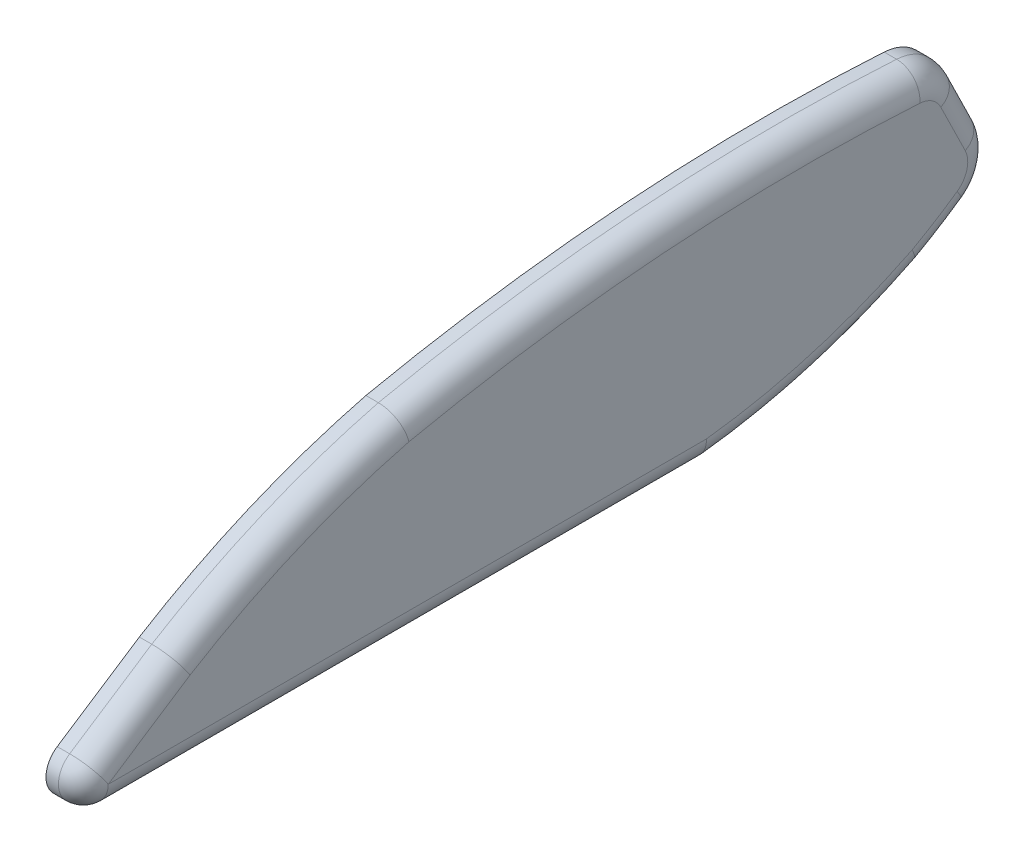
SolidWorks part; units mm, degrees
ref_plane "Alzado" through (0, 0, 0) normal (0, 0, 1) x (1, 0, 0)
ref_plane "Planta" through (0, 0, 0) normal (0, 1, 0) x (1, 0, 0)
ref_plane "Vista lateral" through (0, 0, 0) normal (1, 0, 0) x (0, 0, -1)
sketch "Croquis1" plane through (0, 0, 0) normal (1, 0, 0) x (0, 0, -1)
  line L0 (13448.7874, 5150.8637) -> (13481.7652, 5172.5029)
  line L1 (13454.2736, 5132.5029) -> (13695.0821, 5132.5029)
  line L2 (13797.6803, 5215.2328) -> (13807.4839, 5195.2188)
  arc A0 (13448.7874, 5150.8637) -> (13454.2736, 5132.5029) centre (13454.2736, 5142.5029) ccw
  arc A1 (13572.7711, 5211.0068) -> (13481.7652, 5172.5029) centre (13652.9813, 4894.6253) ccw
  arc A2 (13780.9479, 5226.397) -> (13572.7711, 5211.0068) centre (13733.4027, 4453.8679) ccw
  arc A3 (13797.6803, 5215.2328) -> (13780.9479, 5226.397) centre (13779.7193, 5206.4348) ccw
  arc A4 (13781.7959, 5158.0677) -> (13800.9788, 5170.0267) centre (13677.4696, 5346.7774) ccw
  arc A5 (13800.9788, 5170.0267) -> (13807.4839, 5195.2188) centre (13789.523, 5186.4208) ccw
  arc A6 (13695.0821, 5132.5029) -> (13781.7959, 5158.0677) centre (13665.8802, 5391.3988) ccw
extrude "Saliente-Extruir1" add sketch "Croquis1" along normal blind 15
fillet "Redondeo1" radius 10 10 edges at (15, 5161.6833, -13465.2763) (15, 5195.2188, -13525.8025) (15, 5225.7522, -13676.3383) (15, 5223.0715, -13790.8198) (15, 5205.2258, -13802.5821) (15, 5181.4204, -13808.8878) (15, 5163.7957, -13791.5442) (15, 5141.4955, -13739.5563) (15, 5132.5029, -13574.6778) (15, 5139.64, -13444.6921)
